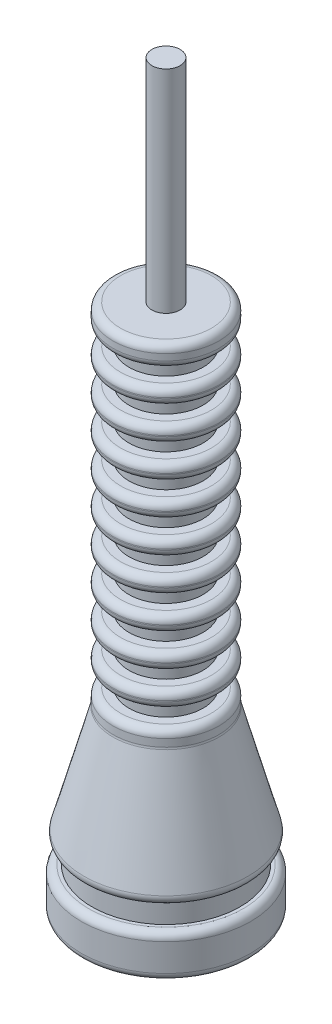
SolidWorks part; units mm, degrees
ref_plane "Front Plane" through (0, 0, 0) normal (0, 0, 1) x (1, 0, 0)
ref_plane "Top Plane" through (0, 0, 0) normal (0, 1, 0) x (1, 0, 0)
ref_plane "Right Plane" through (0, 0, 0) normal (1, 0, 0) x (0, 0, -1)
sketch "Sketch1" plane through (0, 0, 0) normal (0, 0, 1) x (1, 0, 0)
  line L0 (0, 0) -> (0, 50)
  line L1 (1.3314, 50) -> (5, 50)
  line L2 (5, 50) -> (5, 48)
  line L3 (5, 48) -> (3.5, 48)
  line L4 (3.5, 48) -> (3.5, 46.4)
  line L5 (3.5, 46.4) -> (5, 46.4)
  line L6 (0, 0) -> (8, 0)
  line L7 (8, 0) -> (8, 4)
  line L8 (8, 4) -> (7, 4)
  line L9 (7, 4) -> (7, 6)
  line L10 (7, 6) -> (8, 6)
  line L11 (8, 6) -> (5, 17)
  line L12 (5, 46.4) -> (5, 44.9)
  line L13 (5, 44.9) -> (3.5, 44.9)
  line L14 (3.5, 44.9) -> (3.5, 43.3)
  line L15 (3.5, 43.3) -> (5, 43.3)
  line L16 (5, 43.3) -> (5, 41.8)
  line L17 (5, 41.8) -> (3.5, 41.8)
  line L18 (3.5, 41.8) -> (3.5, 40.2)
  line L19 (3.5, 40.2) -> (5, 40.2)
  line L20 (5, 40.2) -> (5, 38.7)
  line L21 (5, 38.7) -> (3.5, 38.7)
  line L22 (3.5, 38.7) -> (3.5, 37.1)
  line L23 (3.5, 37.1) -> (5, 37.1)
  line L24 (5, 37.1) -> (5, 35.6)
  line L25 (5, 35.6) -> (3.5, 35.6)
  line L26 (3.5, 35.6) -> (3.5, 34)
  line L27 (3.5, 34) -> (5, 34)
  line L28 (5, 34) -> (5, 32.5)
  line L29 (5, 32.5) -> (3.5, 32.5)
  line L30 (3.5, 32.5) -> (3.5, 30.9)
  line L31 (3.5, 30.9) -> (5, 30.9)
  line L32 (5, 30.9) -> (5, 29.4)
  line L33 (5, 29.4) -> (3.5, 29.4)
  line L34 (3.5, 29.4) -> (3.5, 27.8)
  line L35 (3.5, 27.8) -> (5, 27.8)
  line L36 (5, 27.8) -> (5, 26.3)
  line L37 (5, 26.3) -> (3.5, 26.3)
  line L38 (3.5, 26.3) -> (3.5, 24.7)
  line L39 (3.5, 24.7) -> (5, 24.7)
  line L40 (5, 24.7) -> (5, 23.2)
  line L41 (5, 23.2) -> (3.5, 23.2)
  line L42 (3.5, 23.2) -> (3.5, 21.6)
  line L43 (3.5, 21.6) -> (5, 21.6)
  line L44 (5, 21.6) -> (5, 20.1)
  line L45 (5, 20.1) -> (3.5, 20.1)
  line L46 (3.5, 20.1) -> (3.5, 18.5)
  line L47 (3.5, 18.5) -> (5, 18.5)
  line L48 (5, 18.5) -> (5, 17)
  line L105 (0, 50) -> (0, 60)
  line L107 (0, 60) -> (1.3314, 60)
  line L108 (1.3314, 60) -> (1.3314, 50)
  point P14 (8.1836, 27.6138)
  point P17 (3.8314, 100.0966)
  point P32 (16.6232, 110)
  point P37 (0, 0)
  point P42 (0, 100.0966)
  point P47 (2.8373, 110)
  dimension "D1" = 50
  dimension "D2" = 8
  dimension "D3" = 4
  dimension "D4" = 1
  dimension "D5" = 2
  dimension "D6" = 1
  dimension "D7" = 5
  dimension "D8" = 2
  dimension "D9" = 1.5
  dimension "D11" = 1.6
  dimension "D12" = 1.5
  dimension "D14" = 10
  dimension "D15" = 1.3314
  dimension "D13" = 10
revolve "Revolve1" add sketch "Sketch1" angle 360 about L0
fillet "Fillet1" radius 0.7 25 edges at (0, 50, -5) (0, 48, -5) (0, 46.4, -5) (0, 44.9, -5) (0, 43.3, -5) (0, 41.8, -5) (0, 40.2, -5) (0, 38.7, -5) (0, 37.1, -5) (0, 35.6, -5) (0, 34, -5) (0, 32.5, -5) (0, 30.9, -5) (0, 29.4, -5) (0, 27.8, -5) (0, 26.3, -5) (0, 24.7, -5) (0, 23.2, -5) (0, 21.6, -5) (0, 20.1, -5) (0, 18.5, -5) (0, 6, -8) (0, 4, -8) (0, 0, -8) (0, 17, -5)
sketch "Sketch4" plane through (0, 60, 0) normal (0, 1, 0) x (1, 0, 0)
  circle A1 centre (0, 0) radius 1.3314
  circle A3 centre (0, 0) radius 1.3314
  dimension "D1" = 0
sketch "Sketch5" plane through (0, 60, 0) normal (0, 1, 0) x (1, 0, 0)
  circle A1 centre (0, 0) radius 1.3314
  circle A4 centre (0, 0) radius 1.3314
  dimension "D1" = 0
extrude "Boss-Extrude2" add sketch "Sketch5" along normal blind 10
